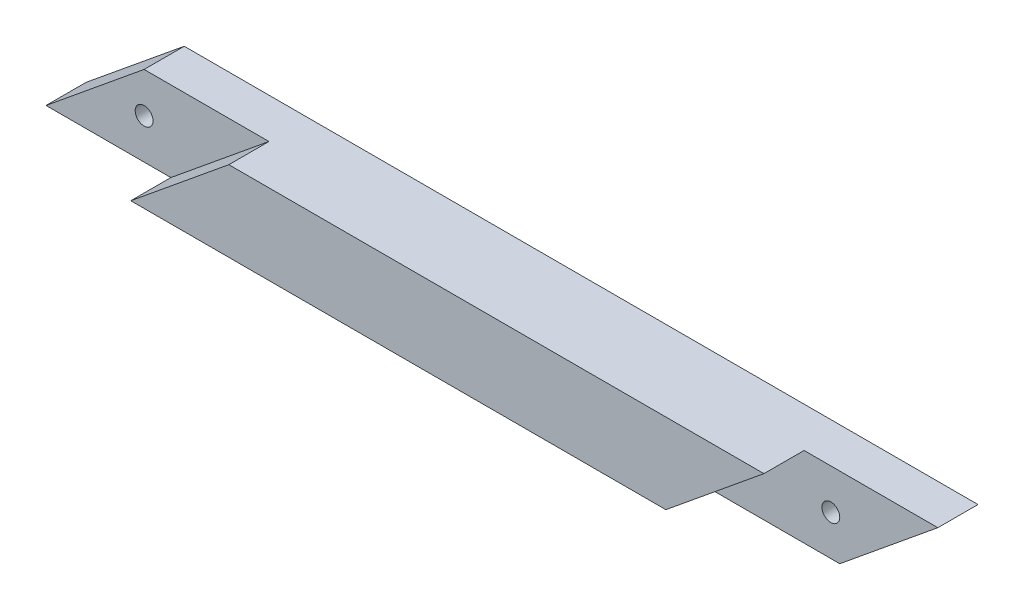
SolidWorks part; units mm, degrees
ref_plane "Plan de face" through (0, 0, 0) normal (0, 0, 1) x (1, 0, 0)
ref_plane "Plan de dessus" through (0, 0, 0) normal (0, 1, 0) x (1, 0, 0)
ref_plane "Plan de droite" through (0, 0, 0) normal (1, 0, 0) x (0, 0, -1)
sketch "Esquisse1" plane through (0, 0, 0) normal (0, 0, 1) x (1, 0, 0)
  line L1 (0, 0) -> (100, 0)
  line L2 (0, 0) -> (0, 9)
  line L3 (0, 9) -> (100, 9)
  line L4 (100, 0) -> (100, 9)
  dimension "D1" = 100
  dimension "D2" = 9
extrude "Extrusion1" add sketch "Esquisse1" along normal blind 9
sketch "Esquisse2" plane through (0, 0, 9) normal (0, 0, 1) x (1, 0, 0)
  line L0 (0, 0) -> (11, 9)
  line L1 (100, 9) -> (0, 9) construction
  line L2 (11, 9) -> (25, 9)
  line L3 (25, 9) -> (14, 0)
  line L4 (0, 0) -> (100, 0) construction
  line L5 (14, 0) -> (0, 0)
  line L6 (0, 0) -> (0, 9)
  line L7 (0, 9) -> (11, 9)
  line L8 (0, 0) -> (-23.6049, 17.4912)
  dimension "D1" = 14
  dimension "D2" = 14
  dimension "D3" = 11
extrude "Enlèv. mat.-Extru.4" cut sketch "Esquisse2" against normal blind 9
sketch "Esquisse5" plane through (0, 0, 9) normal (0, 0, 1) x (1, 0, 0)
  line L0 (11, 9) -> (25, 9)
  line L1 (100, 9) -> (11, 9) construction
  line L2 (25, 9) -> (14, 0)
  line L3 (0, 0) -> (100, 0) construction
  line L4 (14, 0) -> (0, 0)
  line L5 (0, 0) -> (11, 9)
  dimension "D1" = 14
  dimension "D2" = 14
extrude "Enlèv. mat.-Extru.5" cut sketch "Esquisse5" against normal blind 4.5
sketch "Esquisse6" plane through (0, 0, 4.5) normal (0, 0, 1) x (1, 0, 0)
  line L0 (100, 0) -> (100, 9) construction
  line L1 (0, 0) -> (14, 0) construction
  circle A0 centre (11, 4.5) radius 1
  point P5 (100, 4.5)
  dimension "D3" = 2
  dimension "D1" = 89
  dimension "D2" = 4.5
extrude "Enlèv. mat.-Extru.6" cut sketch "Esquisse6" against normal blind 4.5
sketch "Esquisse7" plane through (0, 0, 9) normal (0, 0, 1) x (1, 0, 0)
  line L0 (100, 9) -> (89, 0)
  line L1 (14, 0) -> (100, 0) construction
  line L2 (89, 0) -> (100, 0)
  line L3 (100, 0) -> (100, 9)
  dimension "D1" = 11
extrude "Enlèv. mat.-Extru.7" cut sketch "Esquisse7" against normal blind 9
sketch "Esquisse8" plane through (0, 0, 9) normal (0, 0, 1) x (1, 0, 0)
  line L0 (100, 9) -> (85, 9)
  line L1 (100, 9) -> (25, 9) construction
  line L2 (85, 9) -> (74, 0)
  line L3 (14, 0) -> (89, 0) construction
  line L4 (74, 0) -> (89, 0)
  line L5 (89, 0) -> (100, 9)
  dimension "D1" = 15
  dimension "D2" = 15
extrude "Enlèv. mat.-Extru.8" cut sketch "Esquisse8" against normal blind 4.5
sketch "Esquisse9" plane through (0, 0, 4.5) normal (0, 0, 1) x (1, 0, 0)
  line L0 (100, 9) -> (85, 9) construction
  circle A0 centre (88, 4.5) radius 1
  circle A1 centre (11, 4.5) radius 1 construction
  dimension "D2" = 77
  dimension "D3" = 2
  dimension "D1" = 4.5
extrude "Enlèv. mat.-Extru.9" cut sketch "Esquisse9" against normal blind 4.5
